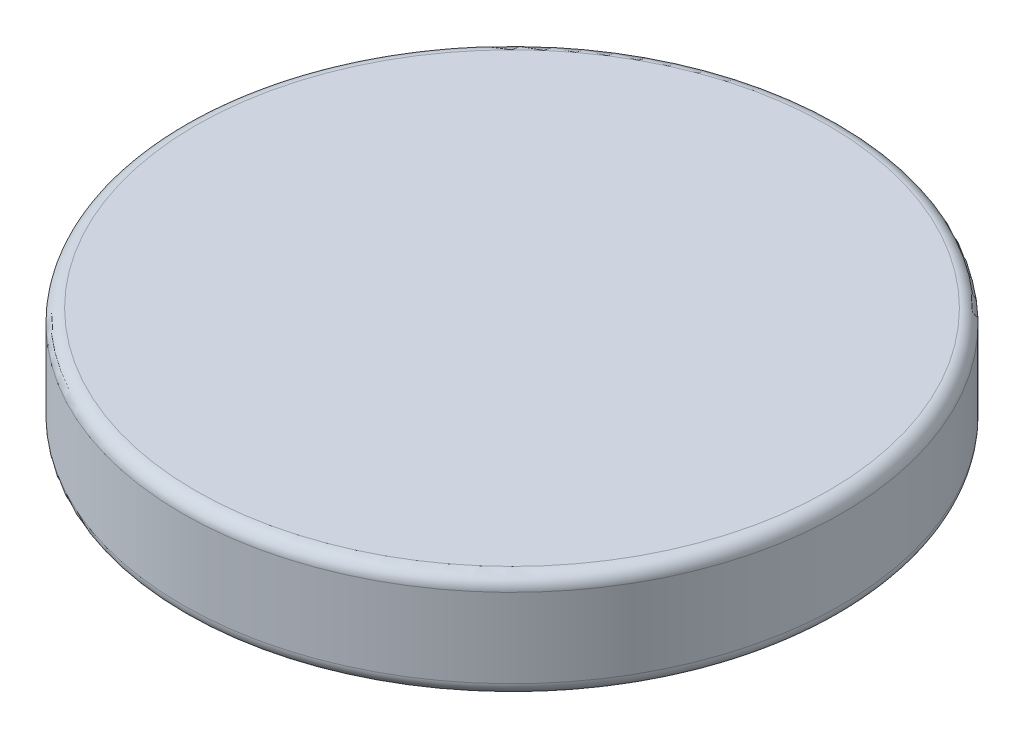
SolidWorks part; units mm, degrees
ref_plane "Piano frontale" through (0, 0, 0) normal (0, 0, 1) x (1, 0, 0)
ref_plane "Piano superiore" through (0, 0, 0) normal (0, 1, 0) x (1, 0, 0)
ref_plane "Piano destro" through (0, 0, 0) normal (1, 0, 0) x (0, 0, -1)
sketch "Schizzo1" plane through (0, 0, 0) normal (0, 1, 0) x (1, 0, 0)
  circle A0 centre (0, 0) radius 12.5
extrude "Estrusione-Estrusione1" add sketch "Schizzo1" along normal blind 4
fillet "Raccordo1" radius 0.5 1 edges at (0, 4, 12.5)
fillet "Raccordo2" radius 0.5 1 edges at (0, 0, 12.5)
